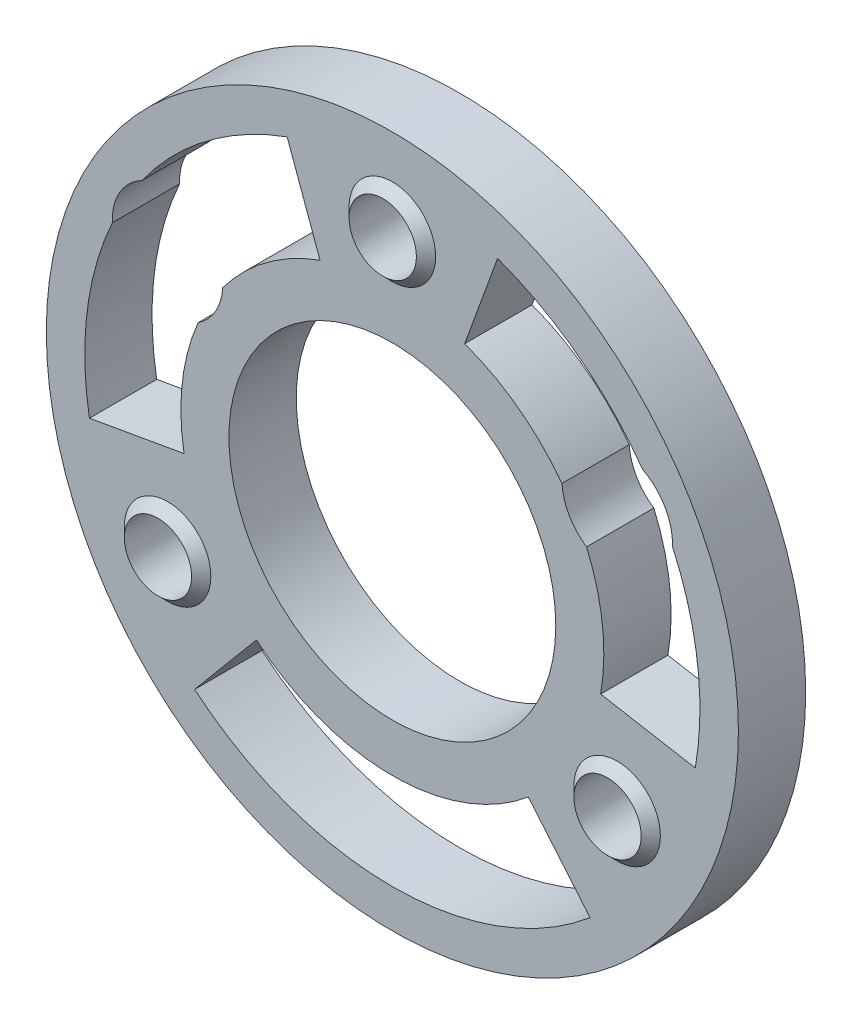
SolidWorks part; units mm, degrees
ref_plane "Front Plane" through (0, 0, 0) normal (0, 0, 1) x (1, 0, 0)
ref_plane "Top Plane" through (0, 0, 0) normal (0, 1, 0) x (1, 0, 0)
ref_plane "Right Plane" through (0, 0, 0) normal (1, 0, 0) x (0, 0, -1)
sketch "Sketch1" plane through (0, 0, 0) normal (0, 0, 1) x (1, 0, 0)
  line L0 (0, 0) -> (11.6913, -6.75) construction
  line L1 (0, 0) -> (-11.6913, -6.75) construction
  line L2 (0, -55) -> (0, 55) construction
  line L3 (0, 0) -> (-5.4723, 15.0351) construction
  line L4 (0, 0) -> (-15.7569, -2.7784) construction
  line L5 (-15.7569, -2.7784) -> (-10.8329, -1.9101)
  line L6 (-5.4723, 15.0351) -> (-3.7622, 10.3366)
  line L7 (15.7569, -2.7784) -> (10.8329, -1.9101)
  line L8 (5.4723, 15.0351) -> (3.7622, 10.3366)
  line L9 (-10.2846, -12.2567) -> (-7.0707, -8.4265)
  line L10 (10.2846, -12.2567) -> (7.0707, -8.4265)
  circle A0 centre (0, 0) radius 8.5
  circle A1 centre (0, 0) radius 11 construction
  circle A2 centre (0, 0) radius 13.5 construction
  circle A3 centre (0, 0) radius 16 construction
  circle A4 centre (0, 0) radius 18
  circle A5 centre (0, 13.5) radius 1.75
  circle A6 centre (-11.6913, -6.75) radius 1.75
  circle A7 centre (11.6913, -6.75) radius 1.75
  arc A8 (-10.8329, -1.9101) -> (-3.7622, 10.3366) centre (0, 0) cw
  arc A9 (-15.7569, -2.7784) -> (-5.4723, 15.0351) centre (0, 0) cw
  arc A10 (3.7622, 10.3366) -> (10.8329, -1.9101) centre (0, 0) cw
  arc A11 (5.4723, 15.0351) -> (15.7569, -2.7784) centre (0, 0) cw
  arc A12 (7.0707, -8.4265) -> (-7.0707, -8.4265) centre (0, 0) cw
  arc A13 (10.2846, -12.2567) -> (-10.2846, -12.2567) centre (0, 0) cw
  point P31 (0, 0)
  dimension "D1" = 17
  dimension "D2" = 2.5
  dimension "D3" = 27
  dimension "D4" = 2
  dimension "D5" = 36
  dimension "D8" = 3.5
  dimension "D6" = 120
  dimension "D7" = 120
  dimension "D9" = 20
  dimension "D10" = 20
  dimension "D11" = 3
extrude "Boss-Extrude1" add sketch "Sketch1" along normal blind 3.5
sketch "Sketch2" plane through (0, 0, 3.5) normal (0, 0, 1) x (1, 0, 0)
  circle A0 centre (0, 13.5) radius 2.25
  circle A1 centre (0, 13.5) radius 1.75
  circle A2 centre (-11.6913, -6.75) radius 2.25
  circle A3 centre (-11.6913, -6.75) radius 1.75
  circle A4 centre (11.6913, -6.75) radius 2.25
  circle A5 centre (11.6913, -6.75) radius 1.75
  circle A6 centre (0, 13.5) radius 1.75 construction
  dimension "D1" = 4.5
extrude "Boss-Extrude2" add sketch "Sketch2" along normal blind 0.5
sketch "Sketch3" plane through (0, 0, 0) normal (0, 0, -1) x (-1, 0, 0)
  line L0 (0, 0) -> (-11.6913, 6.75) construction
  line L1 (0, 0) -> (11.6913, 6.75) construction
  line L2 (0, 2.2) -> (0, -2.2) construction
  circle A0 centre (0, 0) radius 13.5 construction
  circle A1 centre (-11.6913, 6.75) radius 2.875
  circle A2 centre (11.6913, 6.75) radius 2.875
  dimension "D1" = 27
  dimension "D4" = 5.75
  dimension "D2" = 60
  dimension "D3" = 60
extrude "Cut-Extrude1" cut sketch "Sketch3" against normal through all
chamfer "Chamfer1" distance 0.5 angle 45 3 edges at (13.9413, -6.75, 4) (-9.4413, -6.75, 4) (2.25, 13.5, 4)
